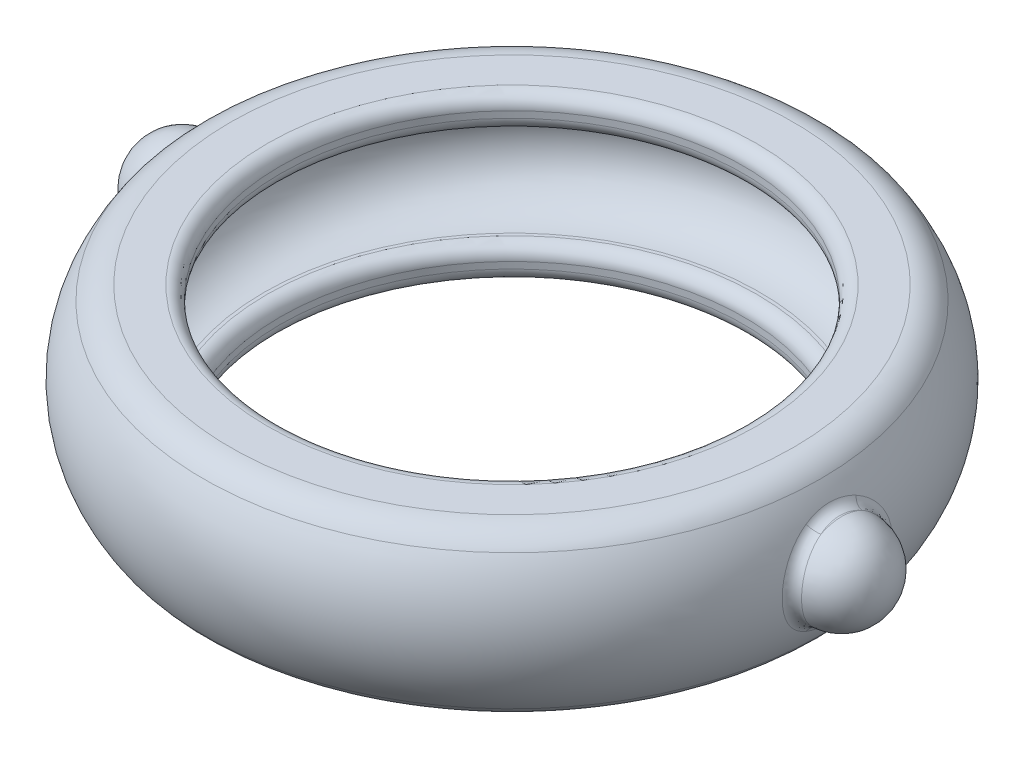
SolidWorks part; units mm, degrees
ref_plane "前视基准面" through (0, 0, 0) normal (0, 0, 1) x (1, 0, 0)
ref_plane "上视基准面" through (0, 0, 0) normal (0, 1, 0) x (1, 0, 0)
ref_plane "右视基准面" through (0, 0, 0) normal (1, 0, 0) x (0, 0, -1)
sketch "草图1" plane through (0, 0, 0) normal (0, 0, 1) x (1, 0, 0)
  line L0 (0, 18.5238) -> (0, -10.9048) construction
  line L2 (7.5, 0) -> (8.6292, 0)
  line L3 (7.1, 0.4) -> (7.1, 0.6)
  line L4 (7.5, 5) -> (8.6292, 5)
  line L6 (9.1, 5.7484) -> (9.1, -1.0538) construction
  line L7 (5.7947, 4) -> (9.4705, 4) construction
  line L8 (5.7947, 1) -> (9.4705, 1) construction
  line L9 (7.6, 5.6525) -> (7.6, -0.1978) construction
  line L10 (7.1, 4.4) -> (7.1, 4.6)
  line L11 (7.5, 4) -> (7.6, 4)
  line L12 (7.5, 1) -> (7.6, 1)
  arc A0 (7.6, 1) -> (7.6, 4) centre (7.6, 2.5) ccw
  arc A1 (9.4499, 4.5714) -> (9.4499, 0.4286) centre (6.475, 2.5) cw
  arc A2 (7.5, 0) -> (7.1, 0.4) centre (7.5, 0.4) cw
  arc A3 (7.1, 0.6) -> (7.5, 1) centre (7.5, 0.6) cw
  arc A4 (7.1, 4.4) -> (7.5, 4) centre (7.5, 4.4) ccw
  arc A5 (7.1, 4.6) -> (7.5, 5) centre (7.5, 4.6) cw
  arc A6 (9.4499, 0.4286) -> (8.6292, 0) centre (8.6292, 1) cw
  arc A7 (9.4499, 4.5714) -> (8.6292, 5) centre (8.6292, 4) ccw
  point P22 (7.1, 1)
  point P28 (7.1, 4)
  point P33 (9.1, 0)
  point P36 (9.1, 5)
  dimension "D3" = 1
  dimension "D1" = 10.1
  dimension "D2" = 0.4
  dimension "D4" = 0.5
revolve "旋转1" add sketch "草图1" angle 360 about L0
ref_plane "基准面1" through (10.1, 0, 0) normal (1, 0, 0) x (0, 0, -1)
sketch "草图4" plane through (10.1, 0, 0) normal (1, 0, 0) x (0, 0, -1)
  line L0 (-16.7, 2.5) -> (16.7, 2.5) construction
  line L1 (0, -2.5) -> (0, 2.5) construction
  line L2 (-10.1, 2.5) -> (10.1, 2.5) construction
  circle A0 centre (0, 2.5) radius 1.4
  arc A1 (-9.4499, 4.5714) -> (-9.4499, 0.4286) centre (-6.475, 2.5) ccw construction
  arc A2 (9.4499, 0.4286) -> (9.4499, 4.5714) centre (6.475, 2.5) ccw construction
  point P14 (0, 0)
  dimension "D1" = 2.8
  dimension "D2" = 0
extrude "凸台-拉伸1" add sketch "草图4" against normal up to next
sketch "草图5" plane through (10.1, 0, 0) normal (1, 0, 0) x (0, 0, -1)
  line L0 (0, 3.9) -> (0, 1.1)
  circle A0 centre (0, 2.5) radius 1.4 construction
  arc A1 (0, 1.1) -> (0, 3.9) centre (0, 2.5) ccw
revolve "旋转2" add sketch "草图5" angle 180 about L0
ref_plane "基准面2" through (-10.1, 0, 0) normal (1, 0, 0) x (0, 0, -1)
sketch "草图6" plane through (-10.1, 0, 0) normal (1, 0, 0) x (0, 0, -1)
  circle A0 centre (0, 2.5) radius 1.4 construction
  circle A1 centre (0, 2.5) radius 1.4
extrude "凸台-拉伸2" add sketch "草图6" along normal up to next
sketch "草图7" plane through (-10.1, 0, 0) normal (-1, 0, 0) x (0, 0, 1)
  line L0 (0, 1.1) -> (0, 3.9)
  circle A0 centre (0, 2.5) radius 1.4 construction
  arc A1 (0, 1.1) -> (0, 3.9) centre (0, 2.5) ccw
revolve "旋转3" add sketch "草图7" angle 180 about L0
fillet "圆角1" radius 0.35 2 edges at (-9.8788, 3.6578, 0.7871) (9.941, 3.3231, 1.1325)
